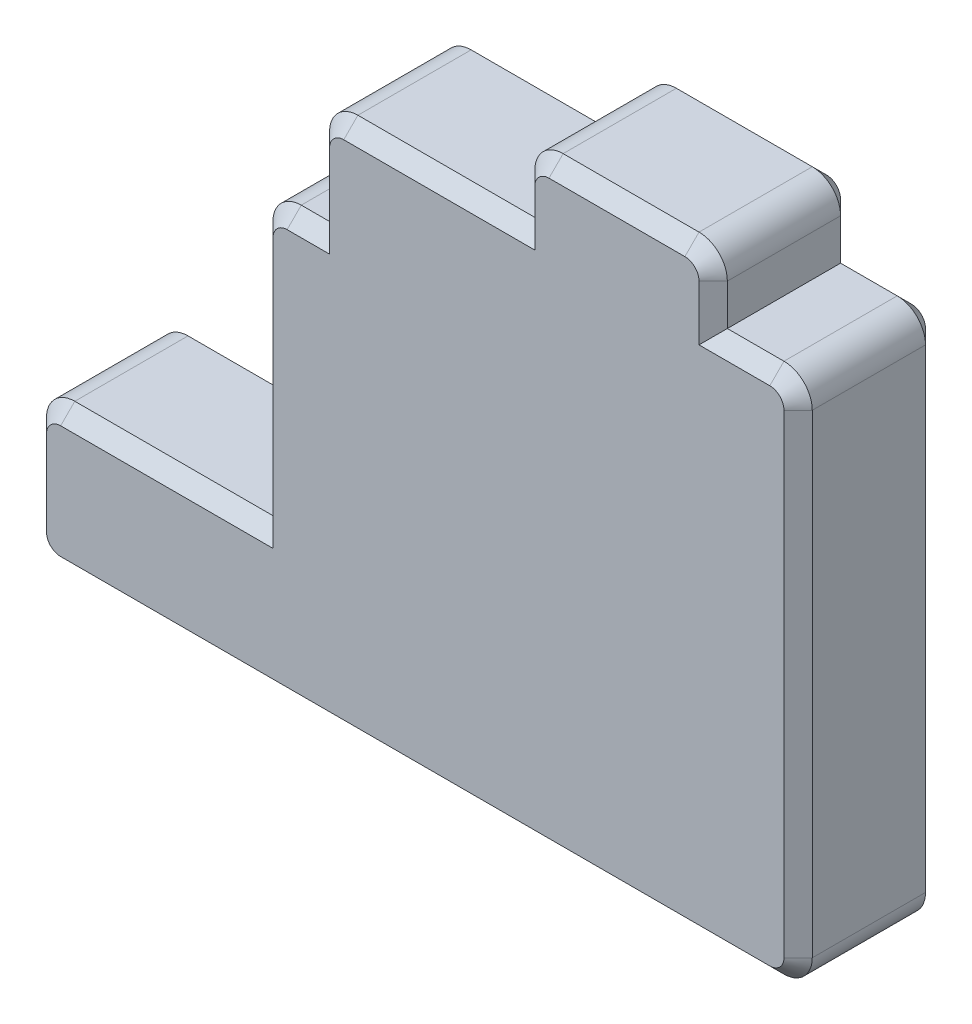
SolidWorks part; units mm, degrees
ref_plane "Płaszczyzna przednia" through (0, 0, 0) normal (0, 0, 1) x (1, 0, 0)
ref_plane "Płaszczyzna górna" through (0, 0, 0) normal (0, 1, 0) x (1, 0, 0)
ref_plane "Płaszczyzna prawa" through (0, 0, 0) normal (1, 0, 0) x (0, 0, -1)
sketch "Szkic1" plane through (0, 0, 0) normal (0, 0, 1) x (1, 0, 0)
  line L0 (-48.031, 11.3536) -> (-48.031, -1.4148)
  line L1 (-55.031, -1.4148) -> (-55.031, 11.3536)
  line L2 (-62.181, -6.0306) -> (-62.181, 15.9694)
  line L3 (-64.181, 22.9694) -> (-64.181, -13.0306)
sketch "Szkic2" plane through (0, 0, 0) normal (0, 0, 1) x (1, 0, 0)
  line L0 (-72.181, -16.0306) -> (-64.181, -16.0306)
  line L1 (-64.181, -16.0306) -> (-64.181, -6.0306)
  line L2 (-64.181, 22.9694) -> (-64.181, -13.0306) construction
  line L3 (-64.181, -6.0306) -> (-62.181, -6.0306)
  line L4 (-62.181, -6.0306) -> (-62.181, -2.2806)
  line L5 (-62.181, -6.0306) -> (-62.181, 15.9694) construction
  line L6 (-48.031, 4.9694) -> (-64.181, 4.9694) construction
  line L7 (-48.031, 11.3536) -> (-48.031, -1.4148) construction
  line L8 (-62.181, -2.2806) -> (-54.931, -2.2806)
  line L9 (-54.931, -2.2806) -> (-54.931, 0.1694)
  line L10 (-54.931, 0.1694) -> (-48.131, 0.1694)
  line L11 (-48.131, 0.1694) -> (-48.131, -2.2806)
  line L12 (-48.131, -2.2806) -> (-45.131, -2.2806)
  line L13 (-45.131, -2.2806) -> (-45.131, -21.0306)
  line L14 (-45.131, -21.0306) -> (-72.181, -21.0306)
  line L15 (-72.181, -21.0306) -> (-72.181, -16.0306)
  line L16 (-55.031, -1.4148) -> (-55.031, 11.3536) construction
  dimension "D1" = 14.5
  dimension "D2" = 6.8
  dimension "D3" = 0.1
  dimension "D4" = 4.8
  dimension "D5" = 3
  dimension "D6" = 5
  dimension "D7" = 21
  dimension "D8" = 8
extrude "Dodanie-wyciągnięcie1" add sketch "Szkic2" along normal blind 5
fillet "Zaokrąglenie1" radius 1 8 edges at (-72.181, -21.0306, 2.5) (-72.181, -16.0306, 2.5) (-64.181, -6.0306, 2.5) (-45.131, -21.0306, 2.5) (-45.131, -2.2806, 2.5) (-48.131, 0.1694, 2.5) (-54.931, 0.1694, 2.5) (-62.181, -2.2806, 2.5)
chamfer "Sfazowanie1" distance 0.5 angle 45 40 edges at (-71.8881, -16.3235, 5) (-67.681, -16.0306, 5) (-64.181, -11.5306, 5) (-63.8881, -6.3235, 5) (-62.681, -6.0306, 5) (-62.181, -4.6556, 5) (-61.8881, -2.5735, 5) (-58.056, -2.2806, 5) (-54.931, -1.5556, 5) (-54.6381, -0.1235, 5) (-51.531, 0.1694, 5) (-48.4239, -0.1235, 5) (-48.131, -1.5556, 5) (-47.131, -2.2806, 5) (-45.4239, -2.5735, 5) (-45.131, -11.6556, 5) (-45.4239, -20.7377, 5) (-58.656, -21.0306, 5) (-71.8881, -20.7377, 5) (-72.181, -18.5306, 5) (-45.4239, -20.7377, 0) (-45.131, -11.6556, 0) (-45.4239, -2.5735, 0) (-47.131, -2.2806, 0) (-48.131, -1.5556, 0) (-48.4239, -0.1235, 0) (-51.531, 0.1694, 0) (-54.6381, -0.1235, 0) (-54.931, -1.5556, 0) (-58.056, -2.2806, 0) (-61.8881, -2.5735, 0) (-62.181, -4.6556, 0) (-62.681, -6.0306, 0) (-63.8881, -6.3235, 0) (-64.181, -11.5306, 0) (-67.681, -16.0306, 0) (-71.8881, -16.3235, 0) (-72.181, -18.5306, 0) (-71.8881, -20.7377, 0) (-58.656, -21.0306, 0)
